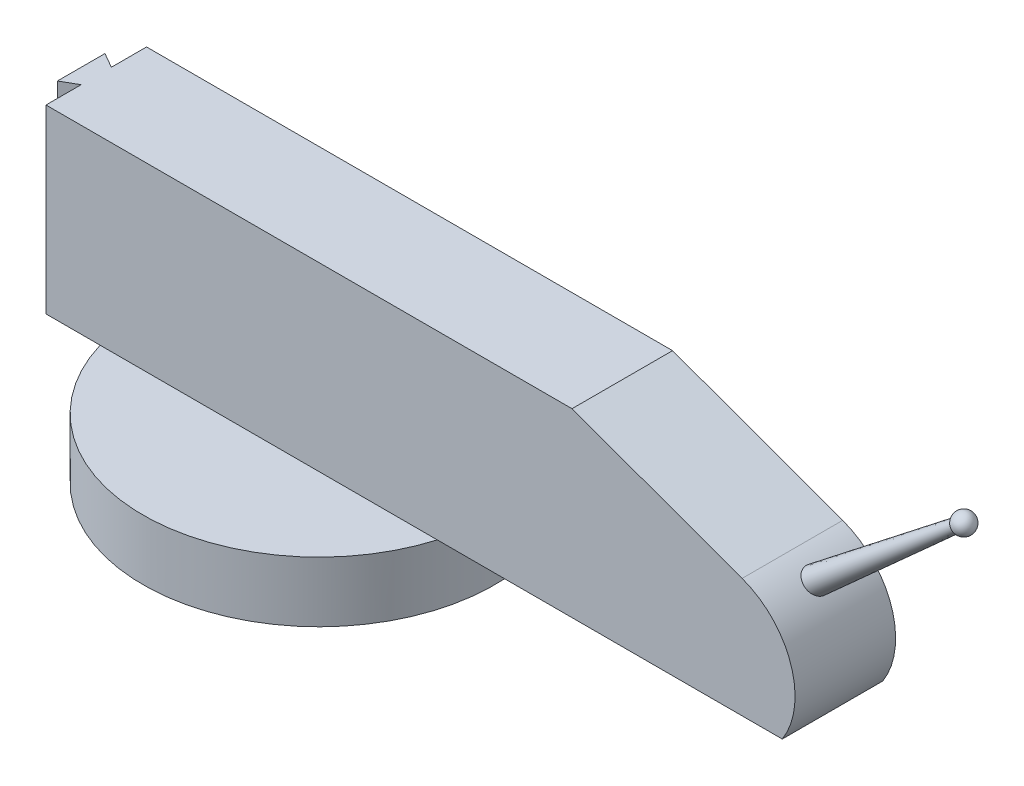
SolidWorks part; units mm, degrees
ref_plane "Face" through (0, 0, 0) normal (0, 0, 1) x (1, 0, 0)
ref_plane "Dessus" through (0, 0, 0) normal (0, 1, 0) x (1, 0, 0)
ref_plane "Droite" through (0, 0, 0) normal (1, 0, 0) x (0, 0, -1)
sketch "Esquisse1" plane through (0, 0, 0) normal (0, 0, 1) x (1, 0, 0)
  line L0 (0, 0) -> (0, 18)
  line L1 (0, 18) -> (53.8173, 18)
  line L2 (0, 0) -> (74.7304, 0)
  line L3 (53.8173, 18) -> (70.7362, 11.842)
  arc A0 (70.7362, 11.842) -> (74.7304, 0) centre (68, 4.3245) cw
  dimension "D3" = 8
  dimension "D1" = 18
  dimension "D2" = 160
  dimension "D4" = 68
  dimension "D5" = 4.3245
extrude "Extrusion1" add sketch "Esquisse1" along normal blind 10
sketch "Esquisse2" plane through (0, 18, 0) normal (0, 1, 0) x (-1, 0, 0)
  line L0 (-1.5, 0) -> (-1.5, 3.5)
  line L1 (-53.8173, 0) -> (0, 0) construction
  line L2 (-1.5, 3.5) -> (0, 2.634)
  line L3 (0, 10) -> (0, 0) construction
  line L4 (0, 2.634) -> (0, 0)
  line L5 (0, 0) -> (-1.5, 0)
  dimension "D1" = 1.5
  dimension "D2" = 60
  dimension "D3" = 3.5
extrude "Enlèv. mat.-Extru.1" cut sketch "Esquisse2" against normal through all
sketch "Esquisse3" plane through (0, 18, 0) normal (0, 1, 0) x (-1, 0, 0)
  line L0 (-1.5, 10) -> (-1.5, 6.5)
  line L1 (-53.8173, 10) -> (0, 10) construction
  line L2 (-1.5, 6.5) -> (0, 7.366)
  line L3 (0, 7.366) -> (0, 10)
  line L4 (0, 10) -> (-1.5, 10)
  dimension "D1" = 3.5
  dimension "D2" = 60
  dimension "D3" = 1.5
extrude "Enlèv. mat.-Extru.2" cut sketch "Esquisse3" against normal through all
ref_plane "Plan1" through (47.3408, 39.7236, 0) normal (0.766, 0.6428, 0) x (0, 0, -1)
sketch "Esquisse4" plane through (47.3408, 39.7236, 0) normal (0.766, 0.6428, 0) x (0, 0, -1)
  line L0 (0, -48.0358) -> (0, -36.3968) construction
  line L1 (-10, -48.0358) -> (0, -48.0358) construction
  circle A0 centre (-5, -39.0358) radius 1.25
  dimension "D1" = 5
  dimension "D2" = 2.5
  dimension "D3" = 9
extrude "Extrusion2" add sketch "Esquisse4" along normal blind 20 draft 2
sketch "Esquisse6" plane through (0, 0, 0) normal (0, -1, 0) x (1, 0, 0)
  line L0 (1.5, 0) -> (74.7304, 0) construction
  line L1 (0, 7.366) -> (0, 2.634) construction
  circle A0 centre (23.6473, 5) radius 17.5
  dimension "D1" = 35
  dimension "D2" = 5
  dimension "D3" = 23.6473
extrude "Extrusion3" add sketch "Esquisse6" along normal blind 6
ref_plane "Plan3" through (0, 0, 5) normal (0, 0, 1) x (1, 0, 0)
sketch "Esquisse7" plane through (0, 0, 5) normal (0, 0, 1) x (1, 0, 0)
  line L0 (88.1079, 22.2537) -> (87.3988, 23.0987) construction
  line L1 (88.4425, 21.8871) -> (87.1255, 23.3923) construction
  line L2 (87.1255, 23.3923) -> (88.4425, 21.8871)
  arc A0 (87.1255, 23.3923) -> (88.4425, 21.8871) centre (87.784, 22.6397) cw
  dimension "D1" = 1
revolve "Révolution3" add sketch "Esquisse7" angle 360 about L1
